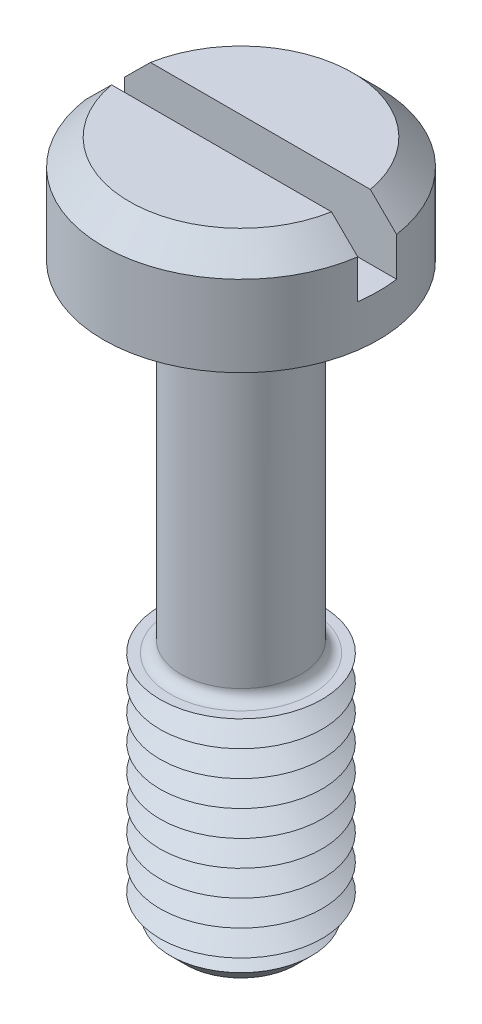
SolidWorks part; units mm, degrees
ref_plane "Front Plane" through (0, 0, 0) normal (0, 0, 1) x (1, 0, 0)
ref_plane "Top Plane" through (0, 0, 0) normal (0, 1, 0) x (1, 0, 0)
ref_plane "Right Plane" through (0, 0, 0) normal (1, 0, 0) x (0, 0, -1)
sketch "Sketch1" plane through (0, 0, 0) normal (0, 1, 0) x (1, 0, 0)
  circle A0 centre (0, 0) radius 4.25
  dimension "D1" = 8.5
extrude "Boss-Extrude1" add sketch "Sketch1" along normal blind 3.3
sketch "Sketch2" plane through (0, 0, 0) normal (0, -1, 0) x (1, 0, 0)
  circle A0 centre (0, 0) radius 1.85
  dimension "D1" = 3.7
extrude "Boss-Extrude2" add sketch "Sketch2" along normal blind 18
sketch "Sketch3" plane through (0, -18, 0) normal (0, -1, 0) x (1, 0, 0)
  circle A0 centre (0, 0) radius 2.5
  dimension "D1" = 5
extrude "Boss-Extrude3" add sketch "Sketch3" against normal blind 7.5
chamfer "Chamfer1" distance 0.8 angle 45 1 edges at (0, -18, -2.5)
sketch "Sketch4" plane through (0, 0, 0) normal (1, 0, 0) x (0, 0, -1)
  line L0 (0, -6.5871) -> (0, -12.0372) construction
sketch "Sketch5" plane through (0, 0, 0) normal (1, 0, 0) x (0, 0, -1)
  line L0 (-2.5, -10.5) -> (-1.8072, -10.9)
  line L1 (-1.8072, -10.9) -> (-2.5, -11.3)
  line L2 (-2.5, -10.5) -> (-2.5, -17.2) construction
  line L3 (-2.5, -11.3) -> (-2.5, -10.5)
  dimension "D1" = 0.8
revolve "Cut-Revolve1" cut sketch "Sketch5" angle 360 about L0
pattern_linear "LPattern1" count 9 spacing 0.8 along (0, -1, 0) of "Cut-Revolve1"
fillet "Fillet1" radius 0.35 2 edges at (0, -10.5, -1.85) (0, 0, -1.85)
chamfer "Chamfer2" distance 0.8 angle 45 1 edges at (0, 3.3, 4.25)
sketch "Sketch6" plane through (0, 3.3, 0) normal (0, 1, 0) x (1, 0, 0)
  line L1 (4.25, -0.6) -> (-4.25, -0.6)
  line L2 (4.25, -0.6) -> (4.25, 0.6)
  line L3 (4.25, 0.6) -> (-4.25, 0.6)
  line L4 (-4.25, -0.6) -> (-4.25, 0.6)
  line L5 (4.25, -0.6) -> (-4.25, 0.6) construction
  line L6 (4.25, 0.6) -> (-4.25, -0.6) construction
  circle A0 centre (0, 0) radius 4.25 construction
  point P0 (0, 0)
  dimension "D1" = 1.2
extrude "Cut-Extrude1" cut sketch "Sketch6" against normal blind 2
